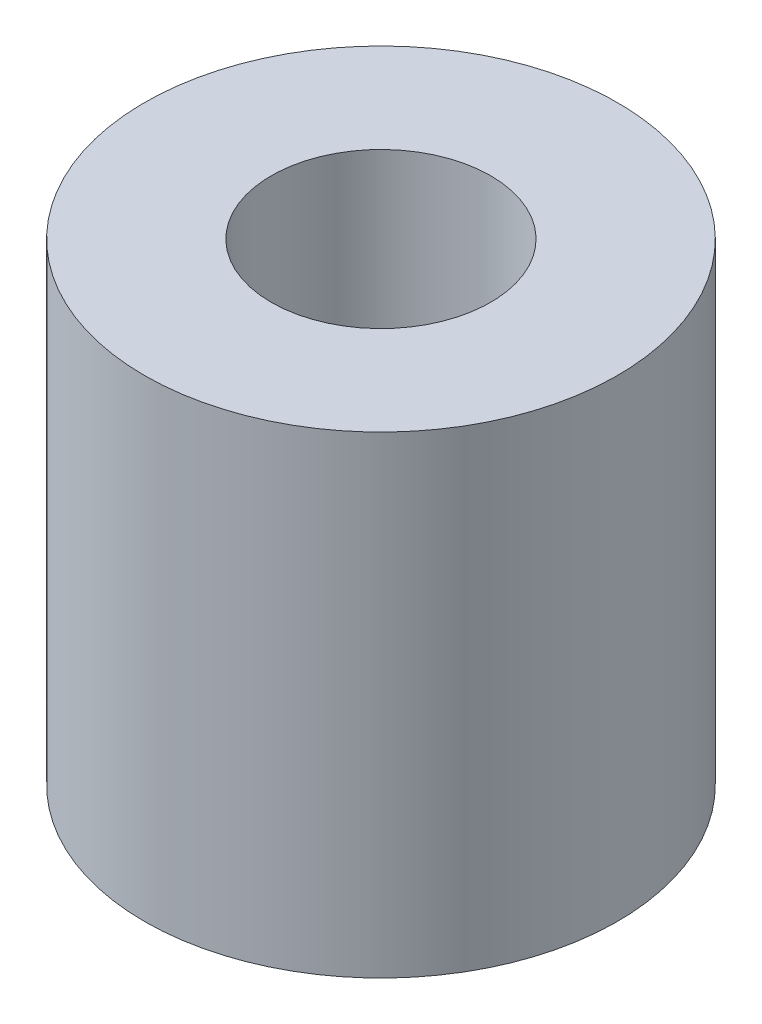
SolidWorks part; units mm, degrees
ref_plane "Front Plane" through (0, 0, 0) normal (0, 0, 1) x (1, 0, 0)
ref_plane "Top Plane" through (0, 0, 0) normal (0, 1, 0) x (1, 0, 0)
ref_plane "Right Plane" through (0, 0, 0) normal (1, 0, 0) x (0, 0, -1)
sketch "Sketch1" plane through (0, 0, 0) normal (0, 1, 0) x (1, 0, 0)
  circle A0 centre (0, 0) radius 1.4732
  circle A1 centre (0, 0) radius 3.175
extrude "Extrude1" add sketch "Sketch1" along normal blind 6.35
